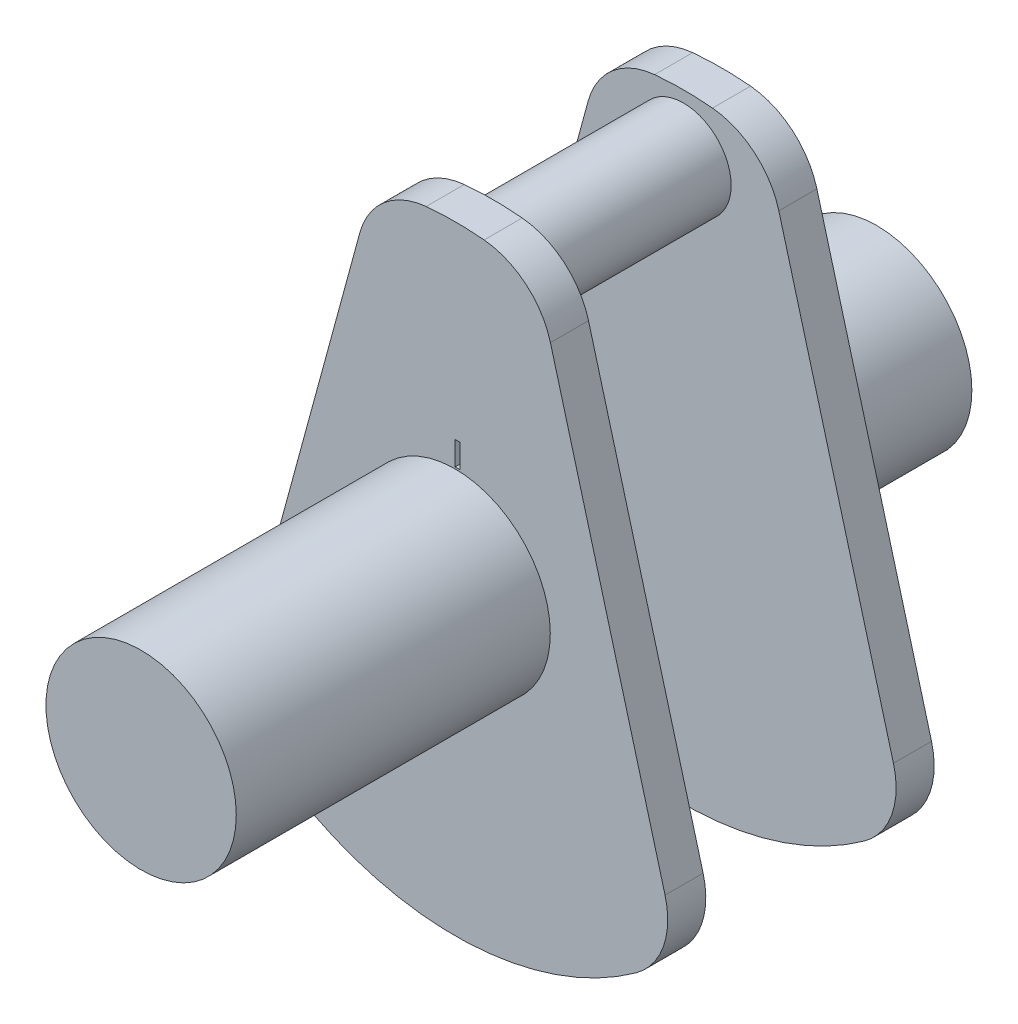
SolidWorks part; units mm, degrees
ref_plane "正面" through (0, 0, 0) normal (0, 0, 1) x (1, 0, 0)
ref_plane "平面" through (0, 0, 0) normal (0, 1, 0) x (1, 0, 0)
ref_plane "右側面" through (0, 0, 0) normal (1, 0, 0) x (0, 0, -1)
sketch "ｽｹｯﾁ2" plane through (0, 0, 0) normal (0, 0, 1) x (1, 0, 0)
  line L0 (0, 6.5) -> (0, -6.5) construction
  line L1 (-2.0028, 5.2986) -> (-4.4119, -3.5528)
  line L2 (2.0028, 5.2986) -> (4.4119, -3.5528)
  arc A0 (-3.8045, -5.2703) -> (3.8045, -5.2703) centre (0, 0) ccw
  arc A1 (0.6089, 6.4714) -> (-0.6089, 6.4714) centre (0, 0) ccw
  arc A2 (2.0028, 5.2986) -> (0.6089, 6.4714) centre (0.459, 4.8785) ccw
  arc A3 (-2.0028, 5.2986) -> (-0.6089, 6.4714) centre (-0.459, 4.8785) cw
  arc A4 (-4.4119, -3.5528) -> (-3.8045, -5.2703) centre (-2.868, -3.973) ccw
  arc A5 (4.4119, -3.5528) -> (3.8045, -5.2703) centre (2.868, -3.973) cw
  point P10 (1.7405, 6.2626)
  point P13 (-1.7405, 6.2626)
  point P16 (-4.6742, -4.5168)
  point P19 (4.6742, -4.5168)
  dimension "D1" = 13
  dimension "D4" = 1.6
  dimension "D5" = 1.6
  dimension "D2" = 30.45
  dimension "D3" = 0.918
extrude "ﾎﾞｽ - 押し出し1" add sketch "ｽｹｯﾁ2" along normal blind 0.8
sketch "ｽｹｯﾁ3" plane through (0, 0, 0.8) normal (0, 0, 1) x (1, 0, 0)
  line L0 (0, 6.5) -> (0, 5.259) construction
  arc A0 (0.6089, 6.4714) -> (-0.6089, 6.4714) centre (0, 0) ccw construction
  circle A1 centre (0, 5.259) radius 1
  dimension "D1" = 2
  dimension "D2" = 5.259
extrude "ﾎﾞｽ - 押し出し2" add sketch "ｽｹｯﾁ3" along normal blind 2
sketch "ｽｹｯﾁ4" plane through (0, 0, 0) normal (0, 0, -1) x (-1, 0, 0)
  circle A0 centre (0, 0) radius 2
  dimension "D1" = 4
extrude "ﾎﾞｽ - 押し出し3" add sketch "ｽｹｯﾁ4" along normal blind 3.26
mirror "ﾐﾗｰ1" about plane through (0, 5.259, 2.8) normal (0, 0, 1)
sketch "ｽｹｯﾁ5" plane through (0, 0, 8.86) normal (0, 0, 1) x (1, 0, 0)
  circle A1 centre (0, 0) radius 2
  circle A2 centre (0, 0) radius 2
  dimension "D1" = 0
extrude "ﾎﾞｽ - 押し出し4" add sketch "ｽｹｯﾁ5" along normal blind 3.34
sketch "ｽｹｯﾁ6" plane through (0, 0, 5.6) normal (0, 0, 1) x (1, 0, 0)
  line L0 (0, 0) -> (0, 4.7415) construction
  line L2 (0, 2.5351) -> (0.1, 2.5351)
  line L3 (0, 2.5351) -> (0, 2.0351)
  line L4 (0, 2.0351) -> (0.1, 2.0351)
  line L5 (0.1, 2.5351) -> (0.1, 2.0351)
  line L6 (0, 2.5351) -> (0.1, 2.0351) construction
  line L7 (0, 2.0351) -> (0.1, 2.5351) construction
  point P7 (0.05, 2.2851)
  point P8 (0.1, 2.11)
  dimension "D1" = 0.1
  dimension "D2" = 0.5
extrude "ｶｯﾄ - 押し出し1" cut sketch "ｽｹｯﾁ6" against normal blind 0.1
